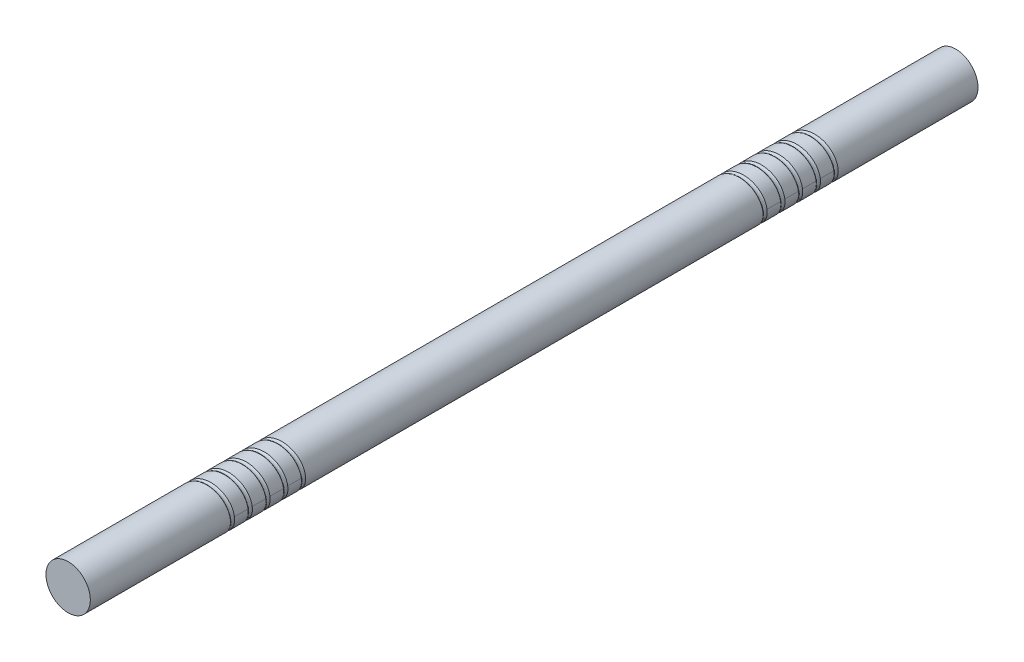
SolidWorks part; units mm, degrees
ref_plane "Front Plane" through (0, 0, 0) normal (0, 0, 1) x (1, 0, 0)
ref_plane "Top Plane" through (0, 0, 0) normal (0, 1, 0) x (1, 0, 0)
ref_plane "Right Plane" through (0, 0, 0) normal (1, 0, 0) x (0, 0, -1)
sketch "Sketch1" plane through (0, 0, 0) normal (0, 0, 1) x (1, 0, 0)
  circle A0 centre (0, 0) radius 25
  dimension "D1" = 50
extrude "Boss-Extrude1" add sketch "Sketch1" along normal blind 1000
ref_plane "Plane1" through (0, 0, 150) normal (0, 0, 1) x (1, 0, 0)
sketch "Sketch2" plane through (0, 0, 150) normal (0, 0, 1) x (1, 0, 0)
  circle A0 centre (0, 0) radius 27.1167
  dimension "D1" = 54.2333
curve "Helix/Spiral1"
sketch "Sketch3" plane through (0, 0, 0) normal (0, 1, 0) x (1, 0, 0)
  circle A0 centre (-27.1167, -150) radius 3.175
  spline S0 degree 3 number of poles 118 (-27.1167, -150) -> (-27.1167, -250) construction
  dimension "D1" = 6.35
sweep "Cut-Sweep1" cut profiles "Sketch3" path "Helix/Spiral1"
pattern_linear "LPattern1" count 2 spacing 600 along (0, 0, -1) of "Cut-Sweep1"
